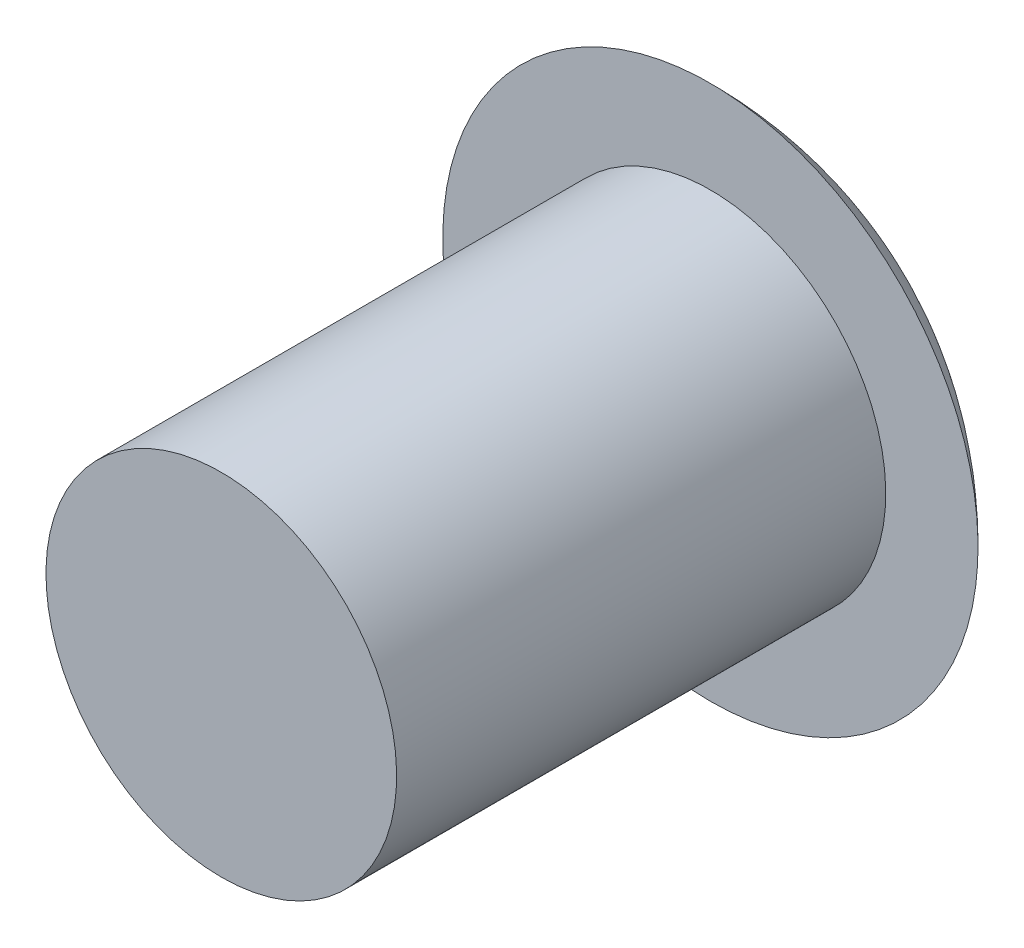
SolidWorks part; units mm, degrees
ref_plane "Front Plane" through (0, 0, 0) normal (0, 0, 1) x (1, 0, 0)
ref_plane "Top Plane" through (0, 0, 0) normal (0, 1, 0) x (1, 0, 0)
ref_plane "Right Plane" through (0, 0, 0) normal (1, 0, 0) x (0, 0, -1)
sketch "Sketch1" plane through (0, 0, 0) normal (1, 0, 0) x (0, 0, -1)
  line L0 (-3, 0) -> (3.5426, 0)
  line L1 (-3, 0) -> (-3, 1.9)
  line L2 (-3, 1.9) -> (2.3, 1.9)
  line L4 (2.3, 1.9) -> (2.3, 2.9)
  arc A0 (2.3, 2.9) -> (3.5426, 0) centre (-0.6988, -0.1012) cw
  point P4 (0, 0)
  dimension "D3" = 4.2426
  dimension "D1" = 6.5426
  dimension "D2" = 1.9
  dimension "D4" = 5.3
  dimension "D5" = 1
revolve "Revolve1" add sketch "Sketch1" angle 360 about L0
